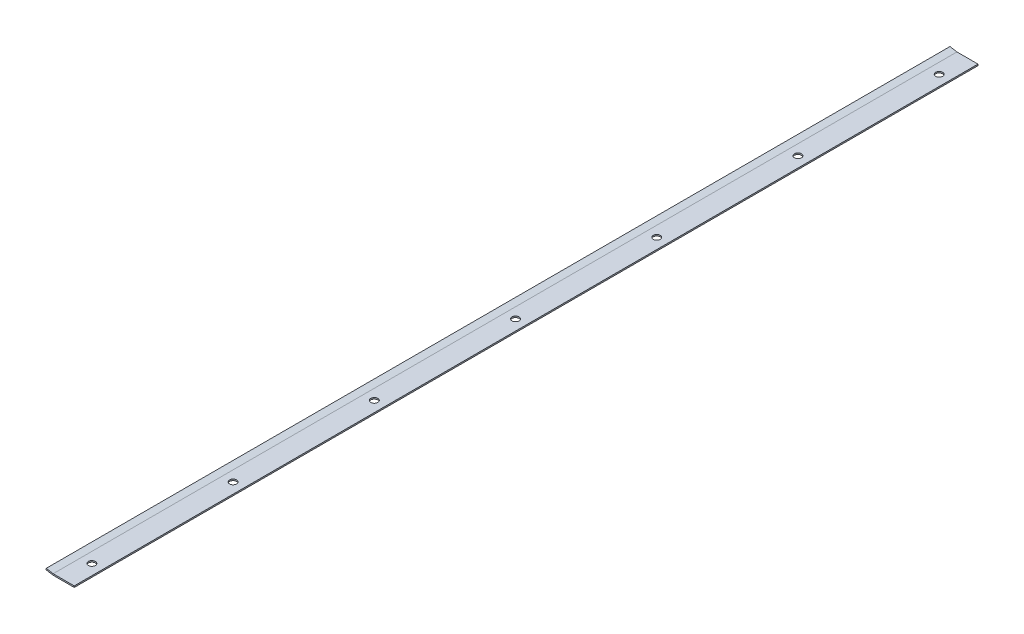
SolidWorks part; units mm, degrees
ref_plane "Plan de face" through (0, 0, 0) normal (0, 0, 1) x (1, 0, 0)
ref_plane "Plan de dessus" through (0, 0, 0) normal (0, 1, 0) x (1, 0, 0)
ref_plane "Plan de droite" through (0, 0, 0) normal (1, 0, 0) x (0, 0, -1)
sketch "Esquisse1" plane through (0, 0, 0) normal (0, 0, 1) x (-1, 0, 0)
  line L0 (0, 0) -> (15, 0)
  line L1 (15, 0) -> (20, -0.8816)
  dimension "D1" = 15
  dimension "D2" = 10
  dimension "D3" = 20
extrude "Extru.-Mince1" add sketch "Esquisse1" along normal mid plane 640 thin
sketch "Esquisse2" plane through (0, 1, 0) normal (0, -1, 0) x (-1, 0, 0)
  line L0 (0, -320) -> (0, 320) construction
  line L2 (0, -320) -> (15, -320) construction
  circle A0 centre (7.5, -300) radius 2.5
  dimension "D1" = 5
  dimension "D2" = 7.5
  dimension "D3" = 20
extrude "Enlèv. mat.-Extru.2" cut sketch "Esquisse2" along normal up to next
pattern_linear "Répétition linéaire1" count 7 spacing 100 along (0, 0, -1) of "Enlèv. mat.-Extru.2"
